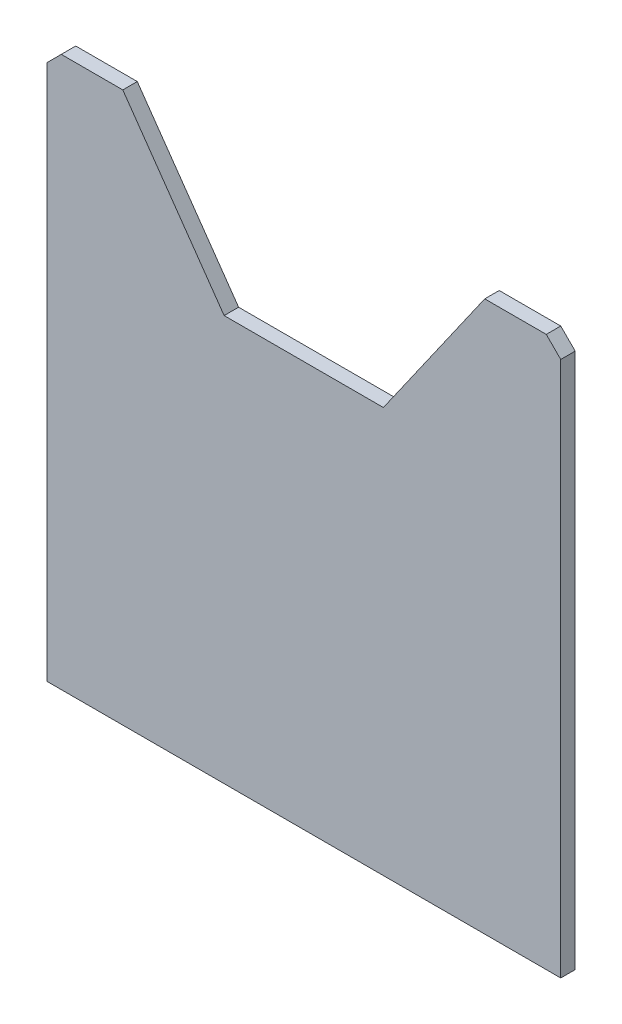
SolidWorks part; units mm, degrees
ref_plane "Plan de face" through (0, 0, 0) normal (0, 0, 1) x (1, 0, 0)
ref_plane "Plan de dessus" through (0, 0, 0) normal (0, 1, 0) x (1, 0, 0)
ref_plane "Plan de droite" through (0, 0, 0) normal (1, 0, 0) x (0, 0, -1)
sketch "Esquisse1" plane through (0, 0, 0) normal (0, 0, 1) x (1, 0, 0)
  line L0 (122.5, 280) -> (232.5, 280)
  line L1 (0, 0) -> (355, 0)
  line L2 (0, 0) -> (0, 370)
  line L3 (10, 380) -> (52.5, 380)
  line L4 (355, 0) -> (355, 370)
  line L5 (177.5, 380) -> (177.5, 0) construction
  line L6 (52.5, 380) -> (122.5, 280)
  line L7 (232.5, 280) -> (302.5, 380)
  line L8 (302.5, 380) -> (345, 380)
  line L9 (0, 370) -> (10, 380)
  line L10 (355, 370) -> (345, 380)
  point P1 (355, 380)
  point P2 (0, 380)
  point P9 (177.5, 280)
  dimension "D1" = 7.5
  dimension "D2" = 380
  dimension "D3" = 110
  dimension "D4" = 7.5
  dimension "D5" = 280
  dimension "D8" = 10
  dimension "D9" = 10
extrude "Boss.-Extru.1" add sketch "Esquisse1" along normal blind 10
